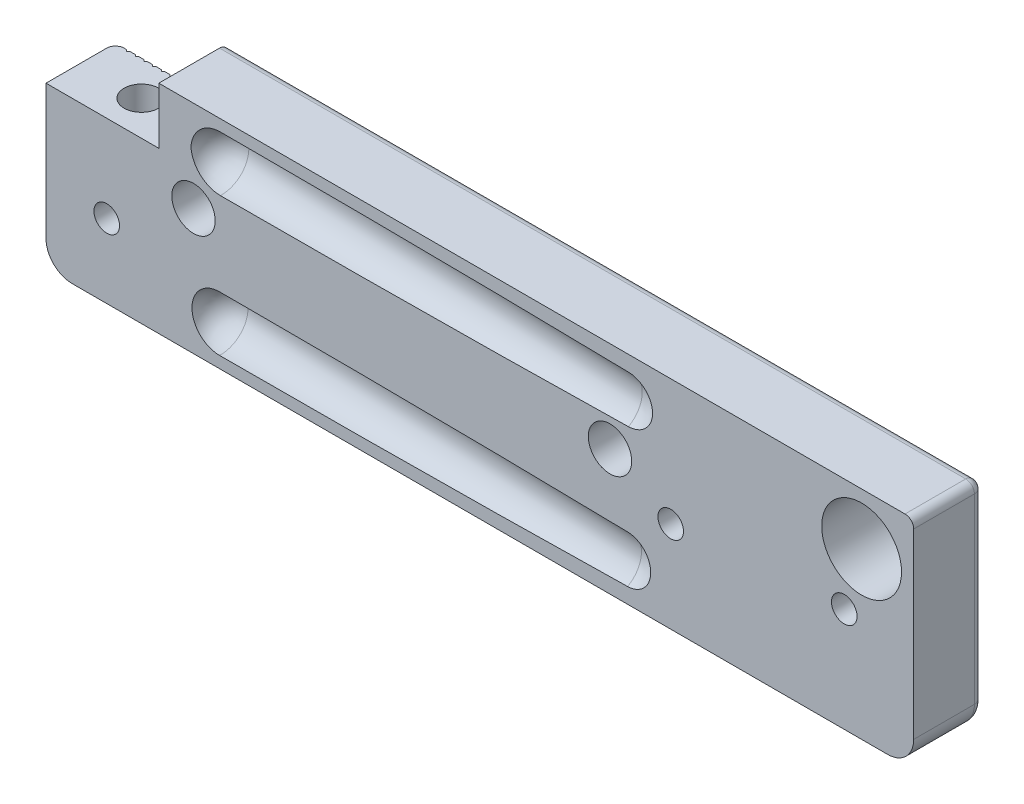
SolidWorks part; units mm, degrees
ref_plane "Plan1" through (0, 0, 0) normal (0, 0, 1) x (1, 0, 0)
ref_plane "Plan2" through (0, 0, 0) normal (0, 1, 0) x (1, 0, 0)
ref_plane "Plan3" through (0, 0, 0) normal (1, 0, 0) x (0, 0, -1)
sketch "Esquisse1" plane through (0, 0, 0) normal (0, 0, 1) x (1, 0, 0)
  line L0 (-42.5, -10.5) -> (57.5, -10.5)
  line L1 (-42.5, -10.5) -> (-42.5, 14.5)
  line L2 (57.5, 14.5) -> (-42.5, 14.5)
  line L3 (57.5, 14.5) -> (57.5, -10.5)
  dimension "D1" = 14.5
  dimension "D2" = 57.5
  dimension "D3" = 42.5
  dimension "D4" = 10.5
extrude "Base-Extrusion" add sketch "Esquisse1" along normal blind 8
fillet "Congé1" radius 3
sketch "Esquisse2" plane through (0, 0, 8) normal (0, 0, 1) x (1, 0, 0)
  line L1 (22.5, 16) -> (22.5, -19) construction
  line L2 (-39.5, -10.5) -> (54.5, -10.5) construction
  line L3 (-42.5, -7.5) -> (-42.5, 14.5) construction
  circle A0 centre (-25.5, 4) radius 2.5
  circle A1 centre (22.5, 4) radius 2.5
  dimension "D1" = 5
  dimension "D2" = 5
  dimension "D3" = 17
  dimension "D4" = 48
  dimension "D5" = 14.5
extrude "Enlèv. mat.-Extru.1" cut sketch "Esquisse2" against normal blind 8
sketch "Esquisse4" plane through (0, 0, 8) normal (0, 0, 1) x (1, 0, 0)
  line L0 (-42.5, -7.5) -> (-42.5, 14.5) construction
  line L4 (29.5, 12) -> (29.5, 0) construction
  line L8 (57.5, 14.5) -> (57.5, -7.5) construction
  line L9 (-39.5, -10.5) -> (54.5, -10.5) construction
  circle A0 centre (-35.5, -2) radius 1.475
  circle A1 centre (29.5, 0) radius 1.475
  dimension "D3" = 10.5
  dimension "D2" = 28
  dimension "D4" = 2.95
  dimension "D1" = 7
extrude "Enlèv. mat.-Extru.3" cut sketch "Esquisse4" against normal blind 8
sketch "Esquisse6" plane through (0, 0, 8) normal (0, 0, 1) x (1, 0, 0)
  line L0 (-22.5, 19) -> (-22.5, -16) construction
  line L1 (-42.5, -7.5) -> (-42.5, 14.5) construction
  dimension "D1" = 20
sketch "Esquisse7" plane through (0, -10.5, 0) normal (0, -1, 0) x (1, 0, 0)
  line L0 (39.5, 18) -> (39.5, -9) construction
  line L3 (57.5, 8) -> (57.5, 0) construction
  line L4 (-39.5, 8) -> (54.5, 8) construction
  point P4 (39.5, 10.15)
  dimension "D1" = 18
  dimension "D2" = 2.15
ref_plane "Plan4" through (-0.3041, 0, 8.7697) normal (-0.0347, 0, 0.9994) x (0.9994, 0, 0.0347)
sketch "Esquisse9" plane through (-0.3041, 0, 8.7697) normal (-0.0347, 0, 0.9994) x (0.9994, 0, 0.0347)
  line L0 (-27, -6) -> (33, -6) construction
  line L2 (-39.199, -10.5) -> (54.7445, -10.5) construction
  line L3 (-22.2092, -2.825) -> (24.7908, -2.825)
  line L4 (-22.2092, 19) -> (-22.2092, -16) construction
  line L5 (24.7908, 0) -> (24.7908, -7.9996) construction
  line L7 (-25.3842, -6) -> (27.9658, -6)
  arc A0 (-22.2092, -2.825) -> (-25.3842, -6) centre (-22.2092, -6) ccw
  arc A1 (24.7908, -2.825) -> (27.9658, -6) centre (24.7908, -6) cw
  dimension "D1" = 4.5
  dimension "D2" = 3.175
  dimension "D3" = 47
revolve "Enlever de la matière-Révolution2" cut sketch "Esquisse9" angle 360 about L0
ref_plane "Plan5" through (-0.3041, 0, 8.7697) normal (-0.0347, 0, 0.9994) x (0.9994, 0, 0.0347)
sketch "Esquisse11" plane through (-0.3041, 0, 8.7697) normal (-0.0347, 0, 0.9994) x (0.9994, 0, 0.0347)
  line L0 (-25.5035, 10) -> (28.2816, 10)
  line L3 (-26, 10) -> (29, 10) construction
  line L4 (57.7427, 14.5) -> (-42.1972, 14.5) construction
  line L5 (-22.1109, 6.825) -> (24.8891, 6.825)
  arc A0 (-22.1109, 6.825) -> (-25.5035, 10) centre (-22.1109, 10.225) cw
  arc A1 (24.8891, 6.825) -> (28.2816, 10) centre (24.8891, 10.225) ccw
  dimension "D1" = 4.5
  dimension "D2" = 3.175
  dimension "D3" = 47
revolve "Enlever de la matière-Révolution5" cut sketch "Esquisse11" angle 360 about L3
sketch "Esquisse12" plane through (0, 0, 0) normal (0, 0, -1) x (-1, 0, 0)
  circle A0 centre (-22.5, 4) radius 4.3
  circle A1 centre (25.5, 4) radius 4.3
  dimension "D1" = 8.6
  dimension "D2" = 8.6
extrude "Enlèv. mat.-Extru.6" cut sketch "Esquisse12" against normal blind 4
sketch "Esquisse17"
  line L0 (57.5, 14.5) -> (57.5, -7.5) construction
  line L1 (57.5, 14.5) -> (-42.5, 14.5) construction
  circle A0 centre (49.5, 1.5) radius 1.475
extrude "Enlèv. mat.-Extru.7" cut sketch "Esquisse13" against normal through all
sketch "Esquisse13" plane through (0, 0, 8) normal (0, 0, 1) x (1, 0, 0)
  line L0 (-45.5, 8) -> (-29.5, 8)
  line L1 (-45.5, 8) -> (-45.5, 16)
  line L2 (-29.5, 16) -> (-45.5, 16)
  line L3 (-29.5, 16) -> (-29.5, 8)
  line L4 (-42.5, -7.5) -> (-42.5, 14.5) construction
  line L5 (57.5, 14.5) -> (-42.5, 14.5) construction
  dimension "D1" = 13
  dimension "D2" = 6.5
extrude "Enlèv. mat.-Extru.11" cut sketch "Esquisse17" against normal through all
sketch "Esquisse14" plane through (0, 8, 0) normal (0, 1, 0) x (-1, 0, 0)
  line L0 (44, 4) -> (30, 4) construction
  line L1 (35.5, -2) -> (35.5, 11) construction
  line L2 (42.5, 0) -> (42.5, 8) construction
  circle A0 centre (35.5, 4) radius 2
  dimension "D2" = 4
  dimension "D1" = 7
extrude "Enlèv. mat.-Extru.8" cut sketch "Esquisse14" against normal blind 6
chamfer "Chanfrein10" distance 1.95 angle 30
sketch "Esquisse15" plane through (0, 0, 8) normal (0, 0, 1) x (1, 0, 0)
  line L0 (57.5, 14.5) -> (57.5, -7.5) construction
  line L1 (57.5, 14.5) -> (-29.5, 14.5) construction
  circle A0 centre (51.5, 8.5) radius 2.5
  dimension "D3" = 5
  dimension "D1" = 6
  dimension "D2" = 6
extrude "Enlèv. mat.-Extru.9" cut sketch "Esquisse15" against normal through all
sketch "Esquisse16" plane through (0, 0, 8) normal (0, 0, 1) x (1, 0, 0)
  circle A0 centre (51.5, 8.5) radius 4.6
  dimension "D1" = 9.2
extrude "Enlèv. mat.-Extru.10" cut sketch "Esquisse16" against normal blind 6.5
fillet "Congé2" radius 1
sketch "Esquisse18" plane through (49, 14.5, -5) normal (0, 1, 0) x (-1, 0, 0)
  line L1 (-8.4, 4.8) -> (-7.6, 4.8)
  line L2 (-8.4, 4.8) -> (-8, 5.2)
  line L3 (-8, 5.2) -> (-7.6, 4.8)
  line L4 (78.5, 5) -> (-7.5, 5) construction
  dimension "D1" = 0.4
  dimension "D2" = 0.2
extrude "Enlèv. mat.-Extru.12" cut sketch "Esquisse18" against normal through all
pattern_linear "Répétition linéaire1" count 100 spacing 1
